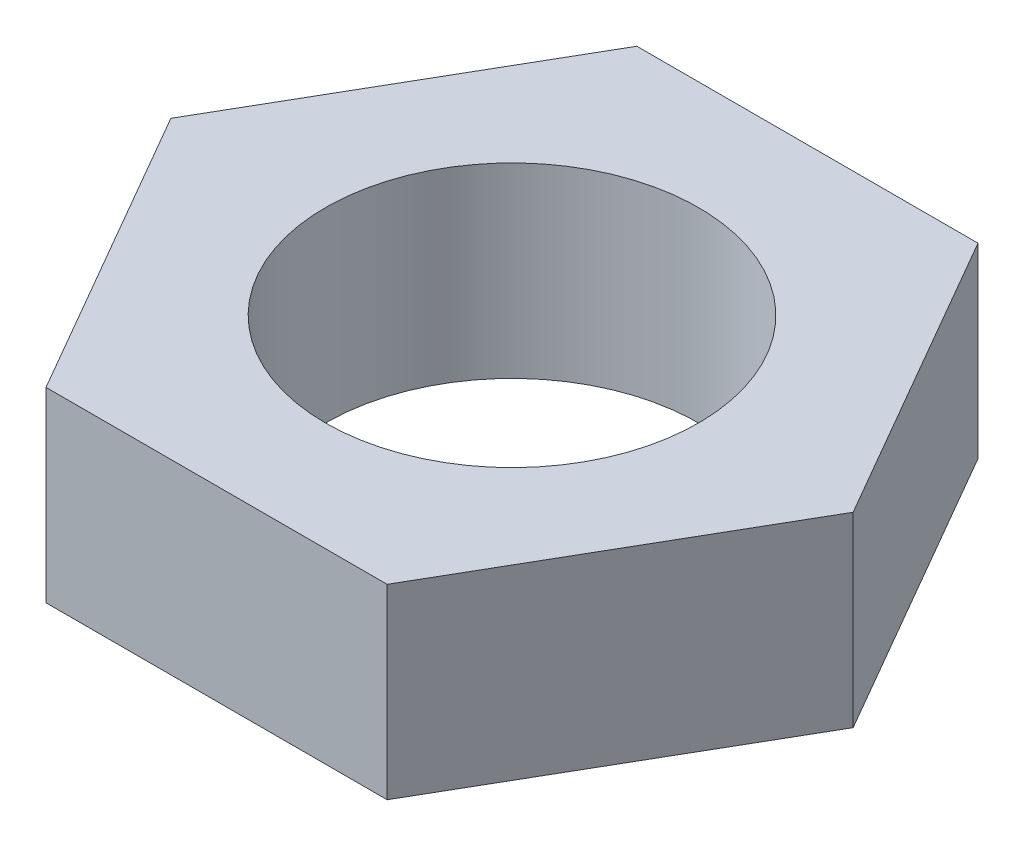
SolidWorks part; units mm, degrees
ref_plane "Front Plane" through (0, 0, 0) normal (0, 0, 1) x (1, 0, 0)
ref_plane "Top Plane" through (0, 0, 0) normal (0, 1, 0) x (1, 0, 0)
ref_plane "Right Plane" through (0, 0, 0) normal (1, 0, 0) x (0, 0, -1)
sketch "Sketch2" plane through (0, 0, 0) normal (0, 1, 0) x (1, 0, 0)
  circle A0 centre (0, 0) radius 19.05
  dimension "D1" = 38.1
sketch "Sketch3" plane through (0, 0, 0) normal (0, 1, 0) x (1, 0, 0)
  line L1 (17.4143, -30.1625) -> (34.8287, 0)
  line L2 (34.8287, 0) -> (17.4143, 30.1625)
  line L3 (17.4143, 30.1625) -> (-17.4143, 30.1625)
  line L4 (-17.4143, 30.1625) -> (-34.8287, 0)
  line L5 (-34.8287, 0) -> (-17.4143, -30.1625)
  line L6 (-17.4143, -30.1625) -> (17.4143, -30.1625)
  circle A0 centre (0, 0) radius 30.1625 construction
  dimension "D1" = 60.325
extrude "Boss-Extrude1" add sketch "Sketch3" along normal blind 19.05
extrude "Cut-Extrude1" cut sketch "Sketch2" along normal blind 101.6
